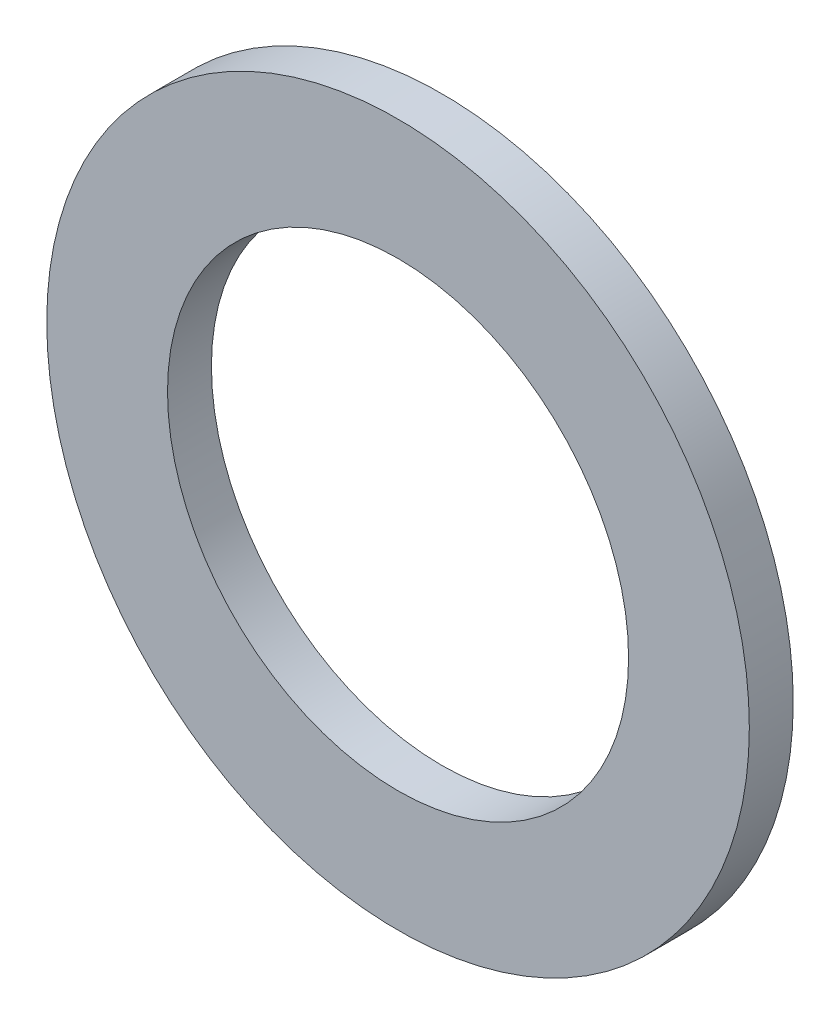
SolidWorks part; units mm, degrees
ref_plane "Plan de face" through (0, 0, 0) normal (0, 0, 1) x (1, 0, 0)
ref_plane "Plan de dessus" through (0, 0, 0) normal (0, 1, 0) x (1, 0, 0)
ref_plane "Plan de droite" through (0, 0, 0) normal (1, 0, 0) x (0, 0, -1)
sketch "Esquisse1" plane through (0, 0, 0) normal (0, 0, 1) x (1, 0, 0)
  circle A0 centre (0, 0) radius 5.25
  circle A1 centre (0, 0) radius 8
  dimension "D1" = 10.5
  dimension "D2" = 16
extrude "Boss.-Extru.1" add sketch "Esquisse1" against normal blind 1
